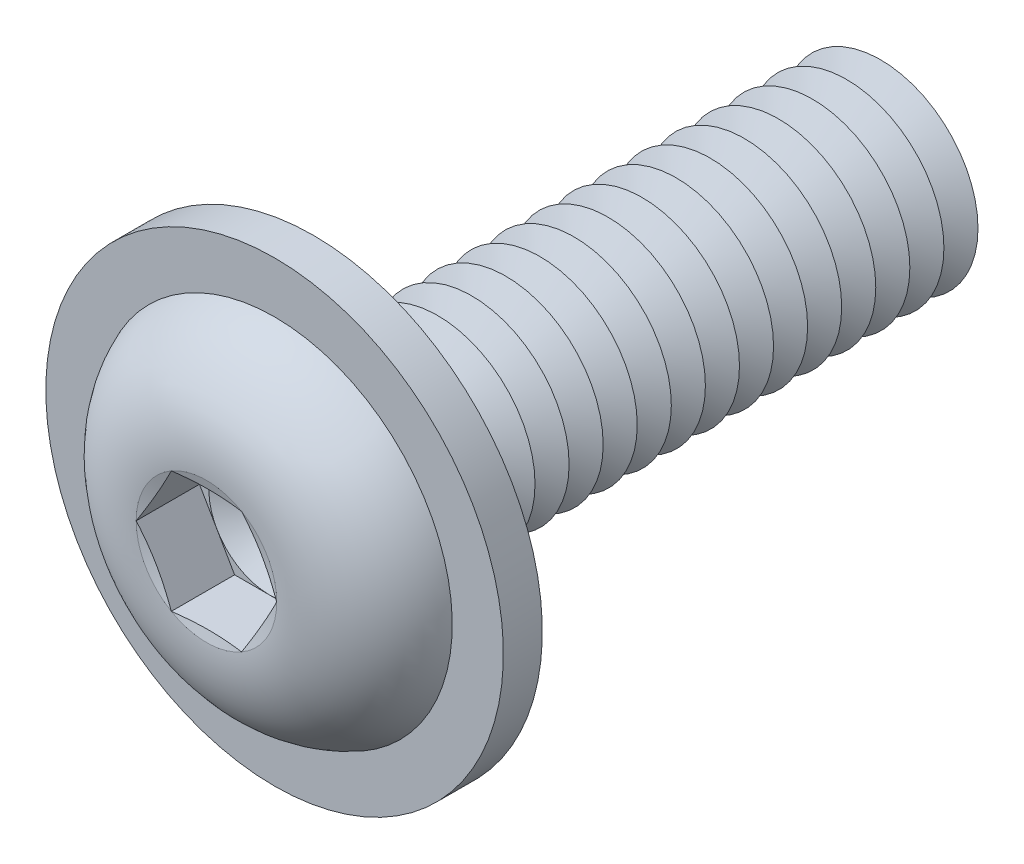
SolidWorks part; units mm, degrees
ref_plane "Front Plane" through (0, 0, 0) normal (0, 0, 1) x (1, 0, 0)
ref_plane "Top Plane" through (0, 0, 0) normal (0, 1, 0) x (1, 0, 0)
ref_plane "Right Plane" through (0, 0, 0) normal (1, 0, 0) x (0, 0, -1)
sketch "Sketch1" plane through (0, 0, 0) normal (1, 0, 0) x (0, 0, -1)
  line L0 (0, 2) -> (0, 3.8)
  line L3 (0, 2) -> (12, 2)
  line L4 (12, 2) -> (12, 0)
  line L5 (12, 0) -> (-2.2, 0) construction
  line L6 (-2.2, 0) -> (12, 0)
  line L7 (-2.2, 1.4434) -> (-2.2, 0.7217) construction
  line L8 (-2.2, 0.7217) -> (-2.2, 0)
  line L9 (-2.2, 1.4434) -> (-2.0066, 0.7217)
  line L10 (-2.0066, 0.7217) -> (-2.2, 0.7217)
  line L11 (12, 0) -> (22.7481, 0) construction
  line L12 (0, 3.8) -> (-2.2, 3.8) construction
  arc A1 (0, 3.8) -> (-2.2, 1.4434) centre (0, 1.5948) ccw
  point P8 (12, 1)
  dimension "D1" = 7.6
  dimension "D2" = 4
  dimension "D3" = 2.2
  dimension "D4" = 2.8868
  dimension "D5" = 12
  dimension "D6" = 15
revolve "Revolve1" add sketch "Sketch1" angle 360 about L5
fillet "Fillet1" radius 0.35 1 edges at (-2, 0, 0)
sketch "Sketch2" plane through (0, 0, 0) normal (1, 0, 0) x (0, 0, -1)
  line L0 (11.65, 2) -> (12.35, 2)
  line L1 (12, 2) -> (0.35, 2) construction
  line L2 (12.35, 2) -> (12, 1.3938)
  line L3 (12, -2) -> (12, 2) construction
  line L4 (12, 1.3938) -> (11.65, 2)
  dimension "D1" = 0.7
revolve "Cut-Revolve1" cut sketch "Sketch2" angle 360 about axis through (0, 0, -12) along (0, 0, -1)
pattern_linear "LPattern1" count 17 spacing 0.7 along (0, 0, 1) of "Cut-Revolve1"
sketch "Sketch3" plane through (0, 0, 2.2) normal (0, 0, 1) x (1, 0, 0)
  line L7 (0.7217, 1.25) -> (-0.7217, 1.25)
  line L8 (-0.7217, 1.25) -> (-1.4434, 0)
  line L9 (-1.4434, 0) -> (-0.7217, -1.25)
  line L10 (-0.7217, -1.25) -> (0.7217, -1.25)
  line L11 (0.7217, -1.25) -> (1.4434, 0)
  line L12 (1.4434, 0) -> (0.7217, 1.25)
  circle A0 centre (0, 0) radius 1.25 construction
  circle A3 centre (0, 0) radius 1.4434 construction
extrude "Cut-Extrude1" cut sketch "Sketch3" against normal blind 1.3
sketch "Sketch4" plane through (0, 0, 0.9) normal (0, 0, 1) x (1, 0, 0)
  line L1 (0.7217, 1.25) -> (-0.7217, 1.25) construction
  circle A0 centre (0, 0) radius 1.25
extrude "Cut-Extrude2" cut sketch "Sketch4" against normal through all draft 60
sketch "Sketch5" plane through (0, 0, 0) normal (0, 0, -1) x (-1, 0, 0)
  circle A0 centre (0, 0) radius 4.7
  circle A1 centre (0, 0) radius 2.35
  circle A2 centre (0, 0) radius 2.35 construction
  dimension "D1" = 9.4
extrude "Boss-Extrude1" add sketch "Sketch5" against normal blind 0.8
